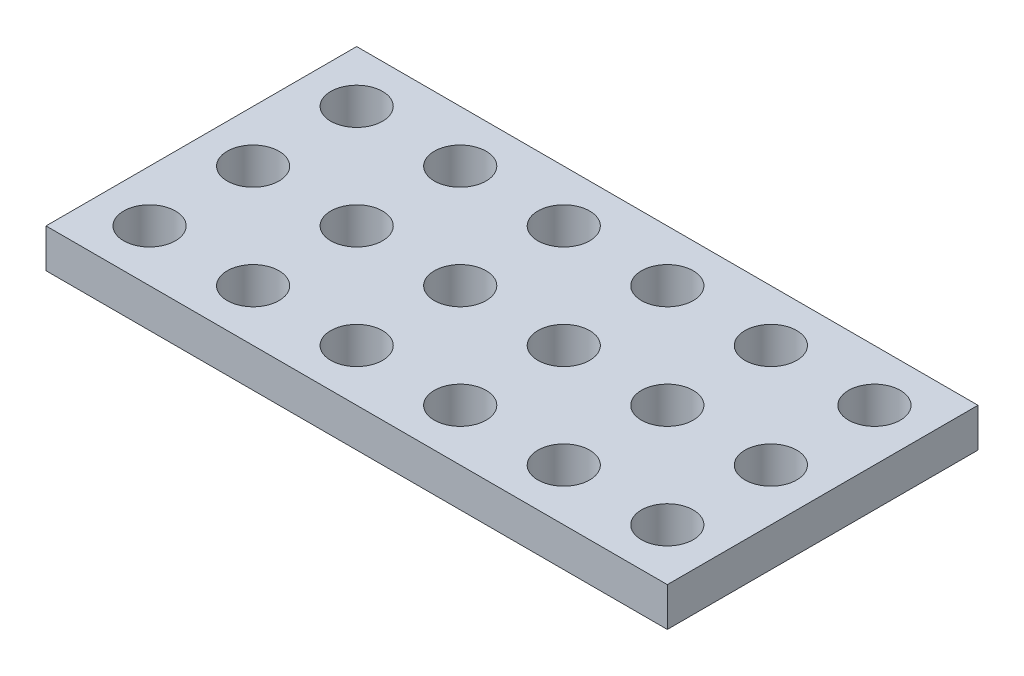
SolidWorks part; units mm, degrees
ref_plane "前视基准面" through (0, 0, 0) normal (0, 0, 1) x (1, 0, 0)
ref_plane "上视基准面" through (0, 0, 0) normal (0, 1, 0) x (1, 0, 0)
ref_plane "右视基准面" through (0, 0, 0) normal (1, 0, 0) x (0, 0, -1)
sketch "草图1" plane through (0, 0, 0) normal (0, 1, 0) x (1, 0, 0)
  line L1 (-21.7333, 10.9333) -> (26.2667, 10.9333)
  line L2 (-21.7333, 10.9333) -> (-21.7333, -13.0667)
  line L3 (-21.7333, -13.0667) -> (26.2667, -13.0667)
  line L4 (26.2667, 10.9333) -> (26.2667, -13.0667)
  circle A0 centre (-17.7333, 6.9333) radius 2
  circle A1 centre (-9.7333, 6.9333) radius 2
  circle A2 centre (-1.7333, 6.9333) radius 2
  circle A3 centre (6.2667, 6.9333) radius 2
  circle A4 centre (14.2667, 6.9333) radius 2
  circle A5 centre (22.2667, 6.9333) radius 2
  circle A6 centre (-17.7333, -1.0667) radius 2
  circle A7 centre (-9.7333, -1.0667) radius 2
  circle A8 centre (-1.7333, -1.0667) radius 2
  circle A9 centre (6.2667, -1.0667) radius 2
  circle A10 centre (14.2667, -1.0667) radius 2
  circle A11 centre (22.2667, -1.0667) radius 2
  circle A12 centre (-17.7333, -9.0667) radius 2
  circle A13 centre (-9.7333, -9.0667) radius 2
  circle A14 centre (-1.7333, -9.0667) radius 2
  circle A15 centre (6.2667, -9.0667) radius 2
  circle A16 centre (14.2667, -9.0667) radius 2
  circle A17 centre (22.2667, -9.0667) radius 2
  dimension "D3" = 4
  dimension "D8" = 2
  dimension "D1" = 24
  dimension "D2" = 48
  dimension "D4" = 4
  dimension "D5" = 2
  dimension "D6" = 2
  dimension "D7" = 2
  dimension "D9" = 2
extrude "凸台-拉伸1" add sketch "草图1" along normal blind 3
